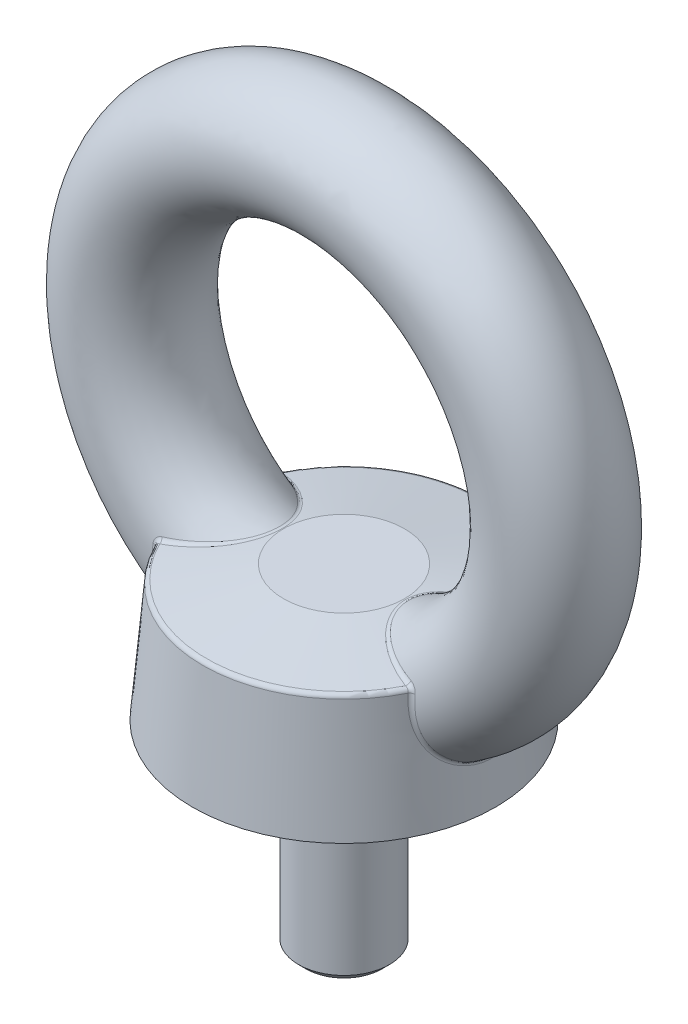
SolidWorks part; units mm, degrees
ref_plane "Front Plane" through (0, 0, 0) normal (0, 0, 1) x (1, 0, 0)
ref_plane "Top Plane" through (0, 0, 0) normal (0, 1, 0) x (1, 0, 0)
ref_plane "Right Plane" through (0, 0, 0) normal (1, 0, 0) x (0, 0, -1)
sketch "Sketch1" plane through (0, 0, 0) normal (0, 0, 1) x (1, 0, 0)
  ellipse E0 centre (0, 18) end of major axis (0, 0) minor radius 18
  dimension "D1" = 36
  dimension "D2" = 36
sketch "Sketch2" plane through (0, 0, 0) normal (1, 0, 0) x (0, 0, -1)
  line L3 (0, 36) -> (0, 0) construction
  circle A0 centre (0, 4) radius 4
  point P5 (0, 0)
sweep "Sweep1" add profiles "Sketch2" path "Sketch1"
sketch "Sketch3" plane through (0, 0, 0) normal (1, 0, 0) x (0, 0, -1)
  line L0 (0, 0) -> (-10, 0)
  line L1 (-10, 0) -> (-9.3001, 8)
  line L2 (-9.3001, 8) -> (-4, 8.9345)
  line L3 (-4, 8.9345) -> (0, 8.9345)
  line L4 (0, 8.9345) -> (0, 0)
revolve "Revolve1" add sketch "Sketch3" angle 360 about L4
fillet "Fillet1" radius 0.3 6 edges at (4.1887, 8.898, 0.3951) (9.7359, 2.8924, -0.4643) (-4.1887, 8.898, -0.3951) (-9.7395, 2.8859, -0.3952) (0, 8, -9.3001) (0, 8, 9.3001)
sketch "Sketch4" plane through (0, 0, 0) normal (0, -1, 0) x (1, 0, 0)
  circle A0 centre (0, 0) radius 3
  dimension "D1" = 6
extrude "Extrude1" add sketch "Sketch4" along normal blind 13
chamfer "Chamfer1" distance 0.5 angle 45 1 edges at (0, -13, -3)
sketch "Sketch5" plane through (0, 0, 0) normal (1, 0, 0) x (0, 0, -1)
  line L0 (-3, 0) -> (-3, -1.366)
  line L1 (-3, 0) -> (-3, -12.5) construction
  line L2 (-2.5, -0.5) -> (-3, -1.366)
  line L3 (-2.5, -0.5) -> (-2.5, -0.25)
  line L4 (-2.75, 0) -> (-3, 0)
  line L5 (-2.75, -0.25) -> (-2.5, -0.25) construction
  arc A1 (-2.5, -0.25) -> (-2.75, 0) centre (-2.75, -0.25) ccw
  point P0 (-2.5, -13)
  dimension "D1" = 30
revolve "Cut-Revolve1" cut sketch "Sketch5" angle 360 about axis through (0, -13, 0) along (0, 1, 0)
equation "\"D4@Sketch3\" = \"D1@Sketch2\""
equation "\"D5@Sketch3\" = \"D1@Sketch2\"/2"
